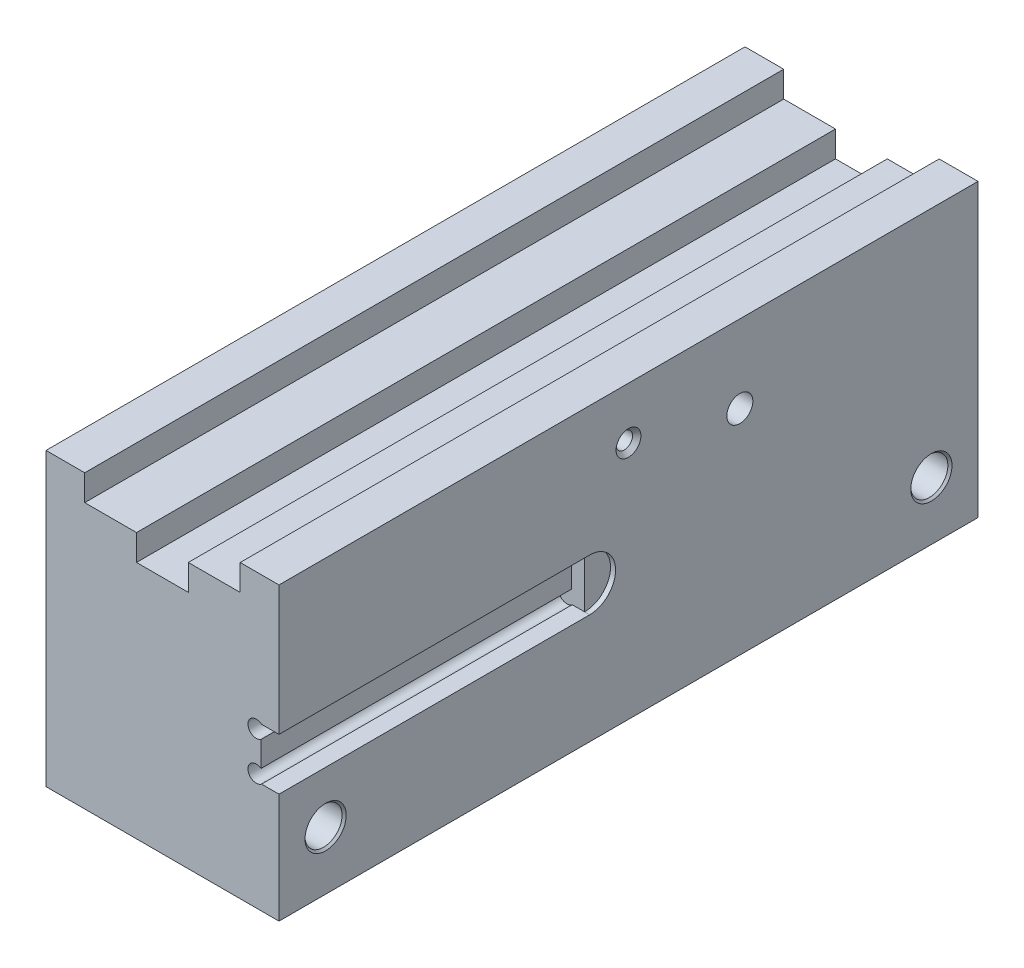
SolidWorks part; units mm, degrees
ref_plane "Front Plane" through (0, 0, 0) normal (0, 0, 1) x (1, 0, 0)
ref_plane "Top Plane" through (0, 0, 0) normal (0, 1, 0) x (1, 0, 0)
ref_plane "Right Plane" through (0, 0, 0) normal (1, 0, 0) x (0, 0, -1)
sketch "Sketch1" plane through (0, 0, 0) normal (0, 0, 1) x (1, 0, 0)
  line L1 (0, 0) -> (57.15, 0)
  line L2 (0, 0) -> (0, 71.4248)
  line L3 (0, 71.4248) -> (57.15, 71.4248)
  line L4 (57.15, 0) -> (57.15, 71.4248)
  dimension "D1" = 71.4248
  dimension "D2" = 57.15
extrude "Boss-Extrude1" add sketch "Sketch1" against normal blind 171.45
sketch "Sketch2" plane through (0, 0, 0) normal (0, 0, 1) x (1, 0, 0)
  line L0 (57.15, 71.4248) -> (0, 71.4248) construction
  line L1 (9.4996, 71.4248) -> (47.625, 71.4248)
  line L2 (9.4996, 71.4248) -> (9.4996, 65.0748)
  line L3 (9.4996, 65.0748) -> (22.1996, 65.0748)
  line L4 (47.625, 71.4248) -> (47.625, 65.0748)
  line L5 (34.8996, 65.0748) -> (47.625, 65.0748)
  line L7 (22.1996, 65.0748) -> (22.1996, 58.7248)
  line L8 (22.1996, 58.7248) -> (34.8996, 58.7248)
  line L9 (34.8996, 65.0748) -> (34.8996, 58.7248)
  line L10 (57.15, 0) -> (57.15, 71.4248) construction
  dimension "D1" = 38.1254
  dimension "D2" = 12.7
  dimension "D3" = 6.35
  dimension "D4" = 9.525
  dimension "D5" = 6.35
  dimension "D6" = 12.7
  dimension "D7" = 12.7254
extrude "Cut-Extrude1" cut sketch "Sketch2" against normal through all
sketch "Sketch3" plane through (0, 0, 0) normal (0, -1, 0) x (1, 0, 0)
  line L0 (0, 0) -> (57.15, 0) construction
  line L2 (0, -171.45) -> (0, 0) construction
  circle A0 centre (26.9875, -34.925) radius 3.2004
  circle A1 centre (7.9375, -85.725) radius 3.2004
  circle A2 centre (46.0375, -85.725) radius 3.2004
  circle A3 centre (26.9875, -136.525) radius 3.2004
  point P12 (0, 0)
  point P13 (0, 0)
  dimension "D1" = 6.4008
  dimension "D2" = 6.4008
  dimension "D3" = 6.4008
  dimension "D4" = 6.4008
  dimension "D6" = 85.725
  dimension "D7" = 50.8
  dimension "D8" = 50.8
  dimension "D9" = 7.9375
  dimension "D10" = 26.9875
  dimension "D11" = 38.1
  dimension "D12" = 26.9875
  dimension "D5" = 85.725
extrude "Cut-Extrude2" cut sketch "Sketch3" against normal blind 6.35
hole_wizard "1/4-20 Tapped Hole1" positions "Sketch4" profile "Sketch5" tap size "1/4-20" standard "ANSI Inch"
sketch "Sketch4" plane through (0, 0, 0) normal (0, -1, 0) x (-1, 0, 0)
  line L0 (0, 171.45) -> (0, 0) construction
  circle A0 centre (-7.9375, 85.725) radius 3.2004 construction
  circle A1 centre (-46.0375, 85.725) radius 3.2004 construction
  point P0 (-7.9375, 60.325)
  point P2 (-46.0375, 60.325)
  point P4 (-46.0375, 111.125)
  point P6 (-7.9375, 111.125)
  point P27 (-38.5967, 45.9054)
  dimension "D6" = 25.4
  dimension "D7" = 25.4
  dimension "D1" = 7.9375
  dimension "D2" = 38.1
  dimension "D3" = 50.8
  dimension "D4" = 7.9375
  dimension "D5" = 25.4
  dimension "D8" = 38.1
sketch "Sketch5" plane through (7.9375, 0, -60.325) normal (1, 0, 0) x (0, 0, -1)
  line L0 (0, 0) -> (0, 12.9638)
  line L1 (0, 12.9638) -> (2.5527, 11.43)
  line L2 (2.5527, 11.43) -> (2.5527, 1.2573)
  line L3 (2.5527, 1.2573) -> (3.81, 0)
  line L5 (3.81, 0) -> (0, 0)
  line L6 (-2.5527, 1.2573) -> (-3.81, 0) construction
  line L10 (0, 12.9638) -> (-2.5527, 11.43) construction
  line L11 (0, -6.35) -> (0, 107.95) construction
  dimension "Tap Drill Dia." = 5.1054
  dimension "Tap Drill Depth" = 11.43
  dimension "Near C'Sink Dia." = 7.62
  dimension "Near C'Sink Angle" = 90
  dimension "Drill Angle" = 118
sketch "Sketch6" plane through (0, 0, 0) normal (0, 0, 1) x (1, 0, 0)
  line L0 (9.4996, 71.4248) -> (0, 71.4248) construction
  line L1 (0, 71.4248) -> (0, 0) construction
  circle A0 centre (1.143, 47.6123) radius 2.4895
  circle A1 centre (1.143, 38.0873) radius 2.7554
  dimension "D2" = 9.525
  dimension "D1" = 23.8125
  dimension "D3" = 1.143
  dimension "D4" = 1.143
extrude "Cut-Extrude3" [suppressed] cut sketch "Sketch6" against normal blind 50.8
sketch "Sketch9" plane through (0, 0, 0) normal (0, 0, 1) x (1, 0, 0)
  line L0 (0, 71.4248) -> (0, 0) construction
  line L3 (0, 0) -> (57.15, 0) construction
  line L4 (57.15, 0) -> (57.15, 71.4248) construction
  line L5 (52.8634, 39.6748) -> (57.15, 39.6748)
  line L6 (52.7431, 36.4093) -> (52.7431, 30.2403)
  line L7 (52.8634, 26.9748) -> (57.15, 26.9748)
  line L8 (57.15, 39.6748) -> (57.15, 26.9748)
  arc A0 (52.8634, 39.6748) -> (52.7431, 36.4093) centre (51.5747, 38.0873) ccw
  arc A1 (52.7431, 30.2403) -> (52.8634, 26.9748) centre (51.5747, 28.5623) ccw
  point P0 (26.9875, 33.3248)
  dimension "D3" = 4.0894
  dimension "D4" = 4.0894
  dimension "D1" = 26.9875
  dimension "D2" = 33.3248
  dimension "D5" = 4.7625
  dimension "D6" = 4.7625
  dimension "D7" = 24.5872
  dimension "D8" = 24.5872
  dimension "D9" = 25.7556
  dimension "D11" = 6.35
extrude "Cut-Extrude4" cut sketch "Sketch9" against normal blind 76.2
sketch "Sketch10" plane through (57.15, 0, 0) normal (1, 0, 0) x (0, 0, -1)
  line L0 (76.2, 36.4093) -> (76.2, 30.2403) construction
  circle A0 centre (76.2, 33.3248) radius 6.35
  dimension "D1" = 12.7
extrude "Cut-Extrude5" cut sketch "Sketch10" against normal blind 1.2319
sketch "Sketch11" plane through (0, 0, 0) normal (0, -1, 0) x (1, 0, 0)
  line L0 (0, 0) -> (57.15, 0) construction
  line L1 (0, -171.45) -> (57.15, -171.45) construction
  circle A0 centre (26.9875, -11.43) radius 4.3561
  circle A1 centre (26.9875, -160.02) radius 4.3561
  dimension "D1" = 8.7122
  dimension "D2" = 8.7122
  dimension "D3" = 11.43
  dimension "D4" = 11.43
extrude "Cut-Extrude6" cut sketch "Sketch11" against normal blind 11.0998
hole_wizard "1/8-27 NPSM Tapped Hole1" positions "Sketch12" profile "Sketch13" tap size "1/8-27 NPSM" standard "ANSI Inch"
sketch "Sketch12" plane through (0, 0, 0) normal (0, -1, 0) x (-1, 0, 0)
  point P0 (-26.9875, 11.43)
  point P3 (-26.9875, 160.02)
sketch "Sketch13" plane through (26.9875, 0, -11.43) normal (1, 0, 0) x (0, 0, -1)
  line L0 (0, 0) -> (0, 25.5919)
  line L1 (0, 25.5919) -> (4.5466, 22.86)
  line L2 (4.5466, 22.86) -> (4.5466, 0.508)
  line L3 (4.5466, 0.508) -> (5.0546, 0)
  line L5 (5.0546, 0) -> (0, 0)
  line L6 (-4.5466, 0.508) -> (-5.0546, 0) construction
  line L10 (0, 25.5919) -> (-4.5466, 22.86) construction
  line L11 (0, -6.35) -> (0, 107.95) construction
  dimension "Tap Drill Dia." = 9.0932
  dimension "Tap Drill Depth" = 22.86
  dimension "Near C'Sink Dia." = 10.1092
  dimension "Near C'Sink Angle" = 90
  dimension "Drill Angle" = 118
hole_wizard "1/8-27 NPSM Tapped Hole2" positions "Sketch14" profile "Sketch15" tap size "1/8-27 NPSM" standard "ANSI Inch"
sketch "Sketch14" plane through (57.15, 0, 0) normal (1, 0, 0) x (0, 0, -1)
  line L0 (0, 0) -> (0, 26.9748) construction
  line L1 (171.45, 0) -> (171.45, 71.4248) construction
  line L2 (171.45, 0) -> (0, 0) construction
  point P0 (11.43, 14.2748)
  point P2 (160.02, 14.2748)
  dimension "D1" = 11.43
  dimension "D2" = 11.43
  dimension "D3" = 14.2748
  dimension "D4" = 14.2748
sketch "Sketch15" plane through (57.15, 14.2748, -11.43) normal (0, 1, 0) x (0, 0, -1)
  line L0 (0, 0) -> (0, 25.5919)
  line L1 (0, 25.5919) -> (4.5466, 22.86)
  line L2 (4.5466, 22.86) -> (4.5466, 0.508)
  line L3 (4.5466, 0.508) -> (5.0546, 0)
  line L5 (5.0546, 0) -> (0, 0)
  line L6 (-4.5466, 0.508) -> (-5.0546, 0) construction
  line L10 (0, 25.5919) -> (-4.5466, 22.86) construction
  line L11 (0, -6.35) -> (0, 107.95) construction
  dimension "Tap Drill Dia." = 9.0932
  dimension "Tap Drill Depth" = 22.86
  dimension "Near C'Sink Dia." = 10.1092
  dimension "Near C'Sink Angle" = 90
  dimension "Drill Angle" = 118
sketch "Sketch16" plane through (57.15, 0, 0) normal (1, 0, 0) x (0, 0, -1)
  line L0 (171.45, 0) -> (171.45, 71.4248) construction
  line L1 (171.45, 0) -> (0, 0) construction
  circle A0 centre (113.03, 52.3748) radius 3.1941
  dimension "D1" = 6.3881
  dimension "D2" = 58.42
  dimension "D3" = 52.3748
extrude "Cut-Extrude7" cut sketch "Sketch16" against normal blind 11.0998
hole_wizard "#10-32 Tapped Hole2" positions "Sketch17" profile "Sketch18" tap size "#10-32" standard "ANSI Inch"
sketch "Sketch17" plane through (57.15, 0, 0) normal (1, 0, 0) x (0, 0, -1)
  line L0 (171.45, 71.4248) -> (0, 71.4248) construction
  point P0 (85.725, 58.7248)
  dimension "D1" = 12.7
  dimension "D2" = 85.725
sketch "Sketch18" plane through (57.15, 58.7248, -85.725) normal (0, 1, 0) x (0, 0, -1)
  line L0 (0, 0) -> (0, 13.1513)
  line L1 (0, 13.1513) -> (2.0193, 11.938)
  line L2 (2.0193, 11.938) -> (2.0193, 1.0287)
  line L3 (2.0193, 1.0287) -> (3.048, 0)
  line L5 (3.048, 0) -> (0, 0)
  line L6 (-2.0193, 1.0287) -> (-3.048, 0) construction
  line L10 (0, 13.1513) -> (-2.0193, 11.938) construction
  line L11 (0, -6.35) -> (0, 107.95) construction
  dimension "Tap Drill Dia." = 4.0386
  dimension "Tap Drill Depth" = 11.938
  dimension "Near C'Sink Dia." = 6.096
  dimension "Near C'Sink Angle" = 90
  dimension "Drill Angle" = 118
